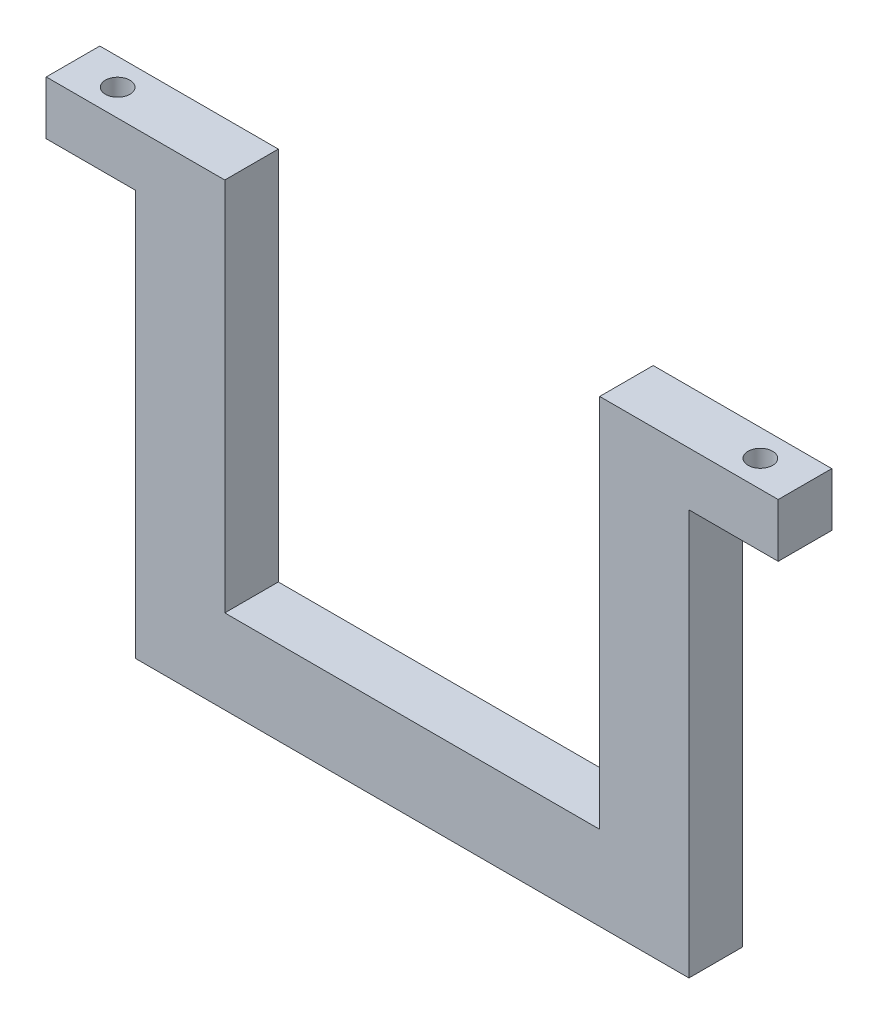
SolidWorks part; units mm, degrees
ref_plane "Front Plane" through (0, 0, 0) normal (0, 0, 1) x (1, 0, 0)
ref_plane "Top Plane" through (0, 0, 0) normal (0, 1, 0) x (1, 0, 0)
ref_plane "Right Plane" through (0, 0, 0) normal (1, 0, 0) x (0, 0, -1)
sketch "Sketch1" plane through (0, 0, 0) normal (0, 0, 1) x (1, 0, 0)
  line L0 (-50.2278, 21) -> (-40.2278, 21)
  line L2 (-40.2278, 21) -> (-40.2278, -21)
  line L3 (-40.2278, -21) -> (1.7722, -21)
  line L4 (1.7722, 21) -> (1.7722, -21)
  line L5 (-40.2278, 21) -> (1.7722, -21) construction
  line L6 (-40.2278, -21) -> (1.7722, 21) construction
  line L7 (1.7722, 21) -> (11.7722, 21)
  line L8 (-50.2278, 21) -> (-50.2278, -30.4225)
  line L9 (-50.2278, -30.4225) -> (11.7722, -30.4225)
  line L10 (11.7722, 21) -> (11.7722, -30.4225)
  line L11 (-50.0371, 30.2353) -> (11.7722, -30.4225) construction
  line L12 (-50.2278, -30.4225) -> (11.5814, 30.2353) construction
  point P0 (-19.2278, 0)
  point P5 (-19.2278, 0)
  dimension "D1" = 42
  dimension "D2" = 42
  dimension "D3" = 10
  dimension "D4" = 10
extrude "Boss-Extrude1" add sketch "Sketch1" along normal blind 6
sketch "Sketch2" plane through (11.7722, 0, 0) normal (1, 0, 0) x (0, 0, -1)
  line L0 (0, -30.4225) -> (0, 21) construction
  line L1 (-6, 21) -> (0, 21)
  line L2 (-6, 21) -> (-6, 15)
  line L3 (-6, 15) -> (0, 15)
  line L4 (0, 21) -> (0, 15)
  dimension "D1" = 6
extrude "Boss-Extrude2" add sketch "Sketch2" along normal blind 10
sketch "Sketch3" plane through (-50.2278, 0, 0) normal (-1, 0, 0) x (0, 0, 1)
  line L0 (6, 21) -> (0, 21) construction
  line L1 (0, 21) -> (6, 21)
  line L2 (0, 21) -> (0, 15)
  line L3 (0, 15) -> (6, 15)
  line L4 (6, 21) -> (6, 15)
  line L5 (0, 21) -> (0, -30.4225) construction
  line L6 (6, 21) -> (6, -30.4225) construction
  dimension "D1" = 6
extrude "Boss-Extrude3" add sketch "Sketch3" along normal blind 10
sketch "Sketch4" plane through (0, 15, 0) normal (0, -1, 0) x (1, 0, 0)
  line L0 (-55.2278, 6) -> (-55.2278, 0) construction
  line L1 (-60.2278, 6) -> (-50.2278, 6) construction
  line L2 (-60.2278, 0) -> (-50.2278, 0) construction
  line L3 (-60.2278, 3) -> (-50.2278, 3) construction
  line L4 (-60.2278, 0) -> (-60.2278, 6) construction
  line L5 (-50.2278, 0) -> (-50.2278, 6) construction
  line L6 (16.7722, 6) -> (16.7722, 0) construction
  line L7 (21.7722, 6) -> (11.7722, 6) construction
  line L8 (21.7722, 0) -> (11.7722, 0) construction
  line L9 (16.7722, 3) -> (21.7722, 3) construction
  line L10 (21.7722, 6) -> (21.7722, 0) construction
  circle A0 centre (-55.2278, 3) radius 1.375
  circle A1 centre (16.7722, 3) radius 1.375
  dimension "D1" = 2.75
  dimension "D2" = 2.75
extrude "Cut-Extrude1" cut sketch "Sketch4" against normal blind 10
